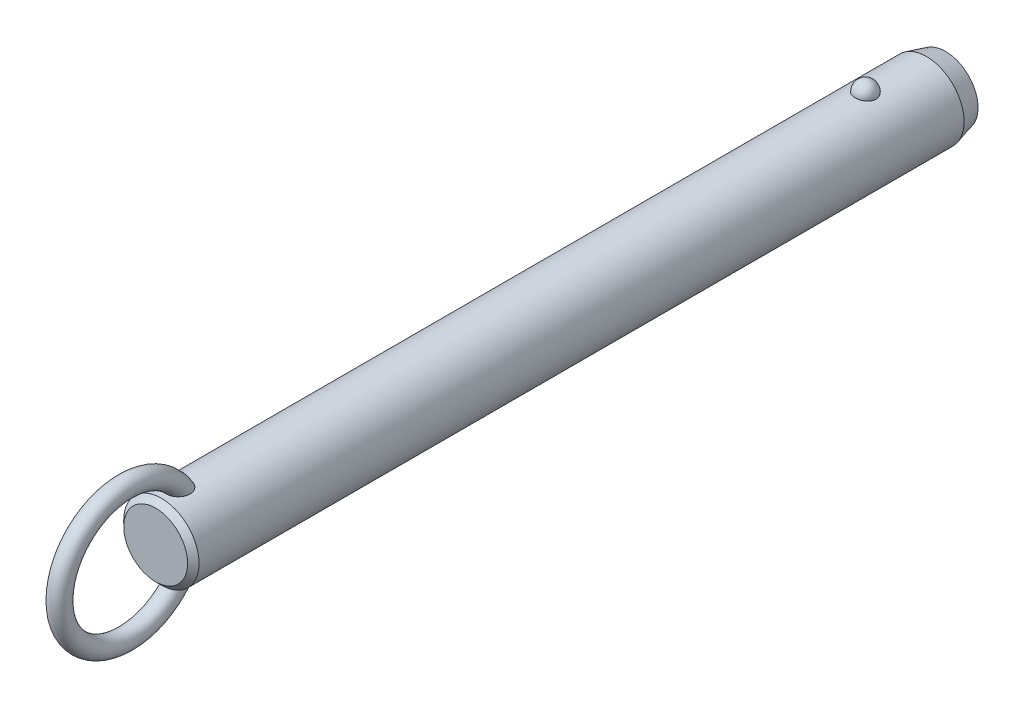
SolidWorks part; units mm, degrees
ref_plane "Front Plane" through (0, 0, 0) normal (0, 0, 1) x (1, 0, 0)
ref_plane "Top Plane" through (0, 0, 0) normal (0, 1, 0) x (1, 0, 0)
ref_plane "Right Plane" through (0, 0, 0) normal (1, 0, 0) x (0, 0, -1)
sketch "Sketch2" plane through (0, 0, 0) normal (0, 0, 1) x (1, 0, 0)
  circle A0 centre (0, 0) radius 7.9
  point P3 (0, 7.9)
  dimension "D1" = 15.8
extrude "Boss-Extrude1" add sketch "Sketch2" along normal blind 137.2
sketch "Sketch3" plane through (0, 0, 0) normal (0, 0, -1) x (-1, 0, 0)
  circle A0 centre (0, 0) radius 7.9
  dimension "D1" = 15.8
extrude "Boss-Extrude2" add sketch "Sketch3" along normal blind 19
chamfer "Chamfer1" distance 4 angle 15 1 edges at (-7.9, 0, -19)
sketch "Sketch12" plane through (0, 0, 0) normal (1, 0, 0) x (0, 0, -1)
  line L0 (-137.2, 7.9) -> (-137.2, -7.9) construction
  point P0 (-137.2, 0)
sketch "Sketch13" plane through (0, 0, 0) normal (1, 0, 0) x (0, 0, -1)
  circle A0 centre (-153.05, 0) radius 15.85
  point P2 (-137.2, 0)
  dimension "D1" = 31.7
sketch "Sketch14" plane through (0, 0, 0) normal (0, 1, 0) x (1, 0, 0)
  circle A0 centre (0, -139.2) radius 2
  point P2 (0, -137.2)
  dimension "D1" = 4
sweep "Sweep1" add profiles "Sketch14" path "Sketch13"
sketch "Sketch15" plane through (0, 0, 137.2) normal (0, 0, 1) x (1, 0, 0)
  circle A0 centre (0, 0) radius 7.9
  dimension "D1" = 15.8
extrude "Boss-Extrude3" add sketch "Sketch15" along normal blind 9.52
chamfer "Chamfer2" distance 1.2 angle 45 1 edges at (7.9, 0, 146.72)
sketch "Sketch18" plane through (0, 0, 0) normal (1, 0, 0) x (0, 0, -1)
  line L0 (15, 7.9) -> (-139.3091, 7.9) construction
  line L1 (2.2, 10.1) -> (2.2, 5.7)
  line L2 (-139.3091, -7.9) -> (15, -7.9) construction
  arc A0 (2.2, 10.1) -> (2.2, 5.7) centre (2.2, 7.9) ccw
  point P4 (0, 7.9)
  dimension "D1" = 18
revolve "Revolve1" add sketch "Sketch18" angle 360 about L1
